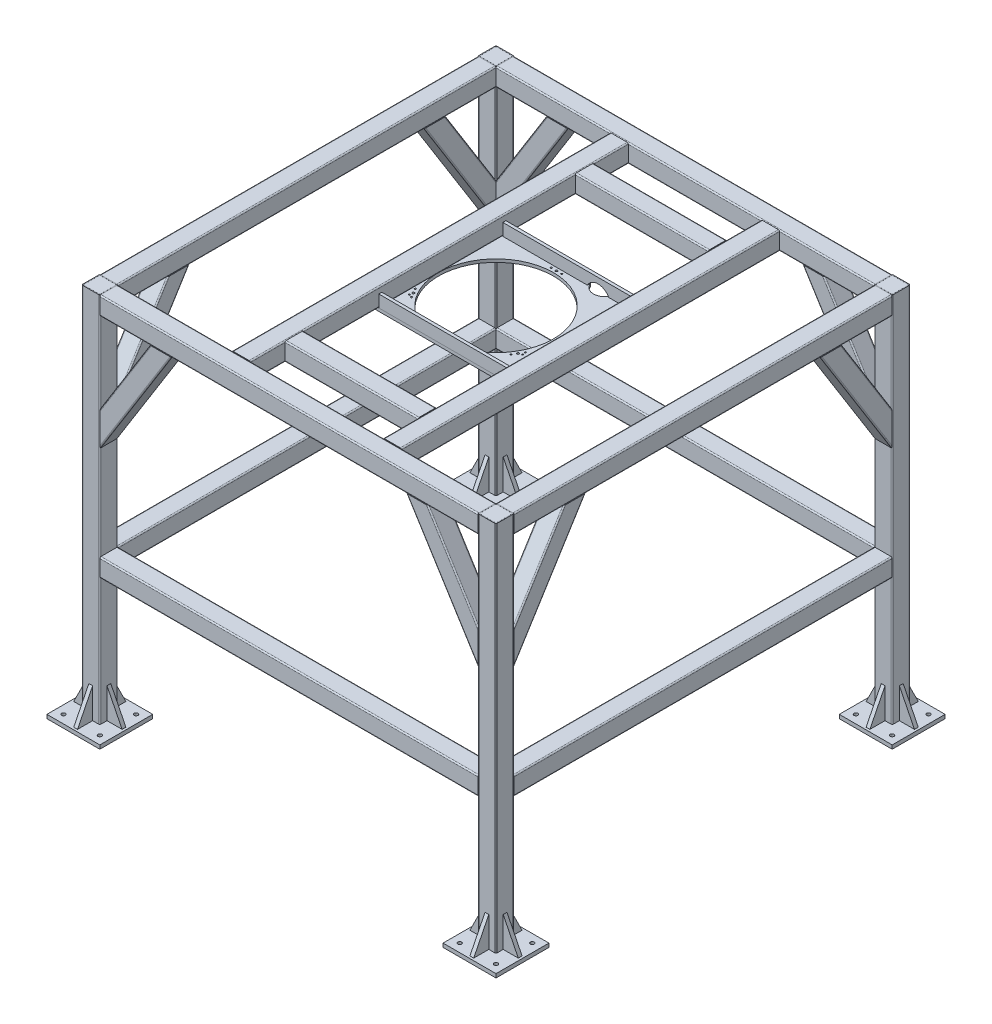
SolidWorks part; units mm, degrees
ref_plane "前视" through (0, 0, 0) normal (0, 0, 1) x (1, 0, 0)
ref_plane "上视" through (0, 0, 0) normal (0, 1, 0) x (1, 0, 0)
ref_plane "右视" through (0, 0, 0) normal (1, 0, 0) x (0, 0, -1)
sketch3d "3D草图2"
  line L0 (-1310, 0, 1310) -> (-1310, 2400, 1310)
  line L1 (-1310, 0, 1310) -> (-1310, 0, -1310)
  line L2 (-1310, 0, 1310) -> (1310, 0, 1310)
  line L3 (1310, 0, 1310) -> (1310, 0, -1310)
  line L4 (-1310, 0, -1310) -> (1310, 0, -1310)
  line L5 (-1310, 2400, 430) -> (1310, 2400, 430)
  line L6 (-1310, 2400, -430) -> (1310, 2400, -430)
  line L7 (-1310, 2400, -1310) -> (-1310, 2400, 1310)
  line L8 (-435, 2400, -1310) -> (-435, 2400, 1310)
  line L9 (-1310, 0, -1310) -> (-1310, 2400, -1310)
  line L10 (-1310, 2400, 1310) -> (1310, 2400, 1310)
  line L11 (565, 2400, -1310) -> (565, 2400, 1310)
  line L12 (1310, 2400, 1310) -> (1310, 2400, -1310)
  line L13 (1310, 2400, -1310) -> (-1310, 2400, -1310)
  line L14 (-1310, 900, 1310) -> (1310, 900, 1310)
  line L15 (1310, 900, 1310) -> (1310, 900, -1310)
  line L16 (-1310, 0, 0) -> (1310, 0, 0) construction
  line L17 (1310, 900, -1310) -> (-1310, 900, -1310)
  line L18 (-1310, 900, -1310) -> (-1310, 900, 1310)
  line L19 (-810, 2400, 1310) -> (-1310, 1600, 1310)
  line L20 (-1310, 1600, 1310) -> (-1310, 2400, 810)
  line L21 (810, 2400, 1310) -> (1310, 1600, 1310)
  line L22 (1310, 1600, 1310) -> (1310, 2400, 810)
  line L23 (1310, 2400, -810) -> (1310, 1600, -1310)
  line L24 (1310, 1600, -1310) -> (810, 2400, -1310)
  line L25 (-810, 2400, -1310) -> (-1310, 1600, -1310)
  line L26 (-1310, 1600, -1310) -> (-1310, 2400, -810)
  line L27 (-435, 2400, -960) -> (565, 2400, -960)
  line L28 (-435, 2400, 960) -> (565, 2400, 960)
  line L45 (1310, 2400, -1310) -> (1310, 0, -1310)
  line L47 (1310, 2400, 1310) -> (1310, 0, 1310)
  line L49 (1310, 2400, 0) -> (-1310, 2400, 0)
  dimension "D1" = 2620
  dimension "D2" = 2620
  dimension "D3" = 2400
  dimension "D7" = 1000
  dimension "D4" = 430
  dimension "D5" = 430
  dimension "D6" = 875
  dimension "D11" = 500
  dimension "D8" = 900
  dimension "D9" = 500
  dimension "D10" = 800
  dimension "D12" = 350
  dimension "D13" = 350
  dimension "D14" = 800
  dimension "D15" = 500
  dimension "D16" = 500
  dimension "D17" = 800
  dimension "D18" = 500
  dimension "D19" = 500
  dimension "D20" = 500
  dimension "D21" = 800
  dimension "D22" = 500
other "矩型管 120X60X4(1)"
ref_plane "基准面1" through (-1310, 0, -1310) normal (0, 1, 0) x (1, 0, 0)
sketch "Sketch12" plane through (-1310, 0, -1310) normal (0, 1, 0) x (1, 0, 0)
  line L0 (-52, -56) -> (52, -56)
  line L1 (-56, -52) -> (-56, 52)
  line L2 (52, 56) -> (-52, 56)
  line L3 (56, 52) -> (56, -52)
  line L4 (-52, -60) -> (52, -60)
  line L5 (-60, -52) -> (-60, 52)
  line L6 (52, 60) -> (-52, 60)
  line L7 (60, 52) -> (60, -52)
  arc A0 (60, 52) -> (52, 60) centre (52, 52) ccw
  arc A1 (52, -60) -> (60, -52) centre (52, -52) ccw
  arc A2 (-60, -52) -> (-52, -60) centre (-52, -52) ccw
  arc A3 (-52, 60) -> (-60, 52) centre (-52, 52) ccw
  arc A4 (-52, 56) -> (-56, 52) centre (-52, 52) ccw
  arc A5 (56, 52) -> (52, 56) centre (52, 52) ccw
  arc A6 (52, -56) -> (56, -52) centre (52, -52) ccw
  arc A7 (-56, -52) -> (-52, -56) centre (-52, -52) ccw
  point P0 (0, 60)
  point P1 (60, 0)
  point P2 (0, -60)
  point P3 (-60, 0)
  point P4 (-60, 60)
  point P5 (60, 60)
  point P6 (60, -60)
  point P7 (-60, -60)
  point P8 (0, 0)
  point P33 (0, 0)
other "剪裁/延伸7"
other "剪裁/延伸6"
sheet metal parameters "钣金2" thickness 3 parameters "D1"=0.7366
sheet metal parameters "钣金4" thickness 3 parameters "D1"=0.7366
sheet metal parameters "钣金7" thickness 1.5 parameters "D1"=0.7366
sheet metal parameters "钣金9" thickness 1.5 parameters "D1"=0.7366
sheet metal parameters "钣金15" thickness 2.5 parameters "D1"=0.7366
sheet metal parameters "钣金16" thickness 2.5 parameters "D1"=0.7366
sheet metal parameters "钣金17" thickness 2.5 parameters "D1"=0.7366
sheet metal parameters "钣金18" thickness 2.5 parameters "D1"=0.7366
sheet metal parameters "钣金19" thickness 2.5 parameters "D1"=0.7366
sheet metal parameters "钣金20" thickness 2.5 parameters "D1"=0.7366
sheet metal parameters "钣金21" thickness 2.5 parameters "D1"=0.7366
sheet metal parameters "钣金28" thickness 2.5 parameters "D1"=0.7366
sheet metal parameters "钣金29" thickness 2.5 parameters "D1"=0.7366
sheet metal parameters "钣金30" thickness 2 parameters "D1"=0.7366
other "剪裁/延伸8"
other "剪裁/延伸9"
other "剪裁/延伸10"
sketch "草图748" plane through (0, 0, 0) normal (0, -1, 0) x (1, 0, 0)
  line L6 (0, 534.4081) -> (0, 0) construction
  line L7 (0, 0) -> (-581.3586, 0) construction
  line L20 (1250, 1370) -> (-1250, 1370) construction
  line L21 (-1135, 1135) -> (-1485, 1135)
  line L22 (-1135, 1135) -> (-1135, 1485)
  line L23 (-1135, 1485) -> (-1485, 1485)
  line L24 (-1485, 1135) -> (-1485, 1485)
  line L25 (-1135, 1135) -> (-1485, 1485) construction
  line L26 (-1135, 1485) -> (-1485, 1135) construction
  line L27 (-1370, 1250) -> (-1370, -1250) construction
  line L28 (1135, 1485) -> (1485, 1135) construction
  line L29 (1135, 1135) -> (1485, 1485) construction
  line L30 (1485, 1135) -> (1485, 1485)
  line L31 (1135, 1485) -> (1485, 1485)
  line L32 (1135, 1135) -> (1135, 1485)
  line L33 (1135, 1135) -> (1485, 1135)
  line L34 (-1135, -1485) -> (-1485, -1135) construction
  line L35 (-1135, -1135) -> (-1485, -1485) construction
  line L36 (-1485, -1135) -> (-1485, -1485)
  line L37 (-1135, -1485) -> (-1485, -1485)
  line L38 (-1135, -1135) -> (-1135, -1485)
  line L39 (-1135, -1135) -> (-1485, -1135)
  line L40 (1135, -1135) -> (1485, -1485) construction
  line L41 (1135, -1485) -> (1485, -1135) construction
  line L42 (1135, -1135) -> (1485, -1135)
  line L43 (1135, -1135) -> (1135, -1485)
  line L44 (1135, -1485) -> (1485, -1485)
  line L45 (1485, -1135) -> (1485, -1485)
  point P0 (-1310, 1310)
  point P18 (1310, 1310)
  point P23 (-1310, -1310)
  point P28 (1310, -1310)
  dimension "D1" = 350
  dimension "D2" = 350
  dimension "D3" = 60
  dimension "D4" = 60
extrude "凸台-拉伸42" add sketch "草图748" along normal blind 25 separate body
sketch "草图755" plane through (0, 2340, 0) normal (0, -1, 0) x (1, 0, 0)
  line L0 (0, 0) -> (0, 240.19) construction
  line L6 (-435, 400) -> (565, 400)
  line L13 (0, 0) -> (-184.4464, 0) construction
  line L18 (-435, 400) -> (-435, -440)
  line L19 (-435, -440) -> (565, -440)
  line L20 (565, 400) -> (565, -440)
  line L21 (-375, 1250) -> (-375, -1250) construction
  line L22 (625, 1250) -> (625, -1250) construction
  circle A1 centre (0, 0) radius 380
  dimension "D1" = 840
  dimension "D2" = 760
  dimension "D3" = 400
  dimension "D4" = 60
  dimension "D5" = 60
extrude "凸台-拉伸43" add sketch "草图755" along normal blind 20 separate body
other "顶端盖1" parameters "D1"=5, "D2"=3, "D3"=3, "D4"=0
sketch "草图766" plane through (0, 2340, 0) normal (0, 1, 0) x (1, 0, 0)
  line L0 (505, -1250) -> (505, 1250) construction
  line L1 (-435, 440) -> (565, 440) construction
  circle A0 centre (255, 465) radius 75
  dimension "D1" = 250
  dimension "D2" = 150
  dimension "D3" = 25
extrude "切除-拉伸1" cut sketch "草图766" against normal through all
hole_wizard "M16 螺纹孔2" positions "草图767" profile "草图768" tap size "M16" standard "GB"
sketch "草图767" plane through (0, 2340, 0) normal (0, 1, 0) x (1, 0, 0)
  point P0 (0, 400)
  dimension "D1" = 400
sketch "草图768" plane through (0, 2340, -400) normal (1, 0, 0) x (0, 0, 1)
  line L0 (0, 0) -> (0, 42.206)
  line L1 (0, 42.206) -> (7, 38)
  line L2 (7, 38) -> (7, 0)
  line L5 (7, 0) -> (0, 0)
  line L10 (0, 42.206) -> (-7, 38) construction
  line L11 (0, -6.35) -> (0, 107.95) construction
  dimension "螺纹孔钻头直径" = 14
  dimension "螺纹孔钻头深度" = 38
  dimension "导头角度" = 118
hole_wizard "M12 螺纹孔2" positions "草图769" profile "草图770" tap size "M12" standard "GB"
sketch "草图769" plane through (0, 2340, 0) normal (0, 1, 0) x (1, 0, 0)
  line L0 (0, 0) -> (0, 157.172) construction
  line L2 (-35, 400) -> (0, 0) construction
  line L4 (35, 400) -> (0, 0) construction
  circle A0 centre (0, 400) radius 7 construction
  point P0 (35, 400)
  point P2 (-35, 400)
  dimension "D3" = 35
  dimension "D1" = 400
  dimension "D2" = 35
sketch "草图770" plane through (35, 2340, -400) normal (1, 0, 0) x (0, 0, 1)
  line L0 (0, 0) -> (0, 35.8144)
  line L1 (0, 35.8144) -> (5.1, 32.75)
  line L2 (5.1, 32.75) -> (5.1, 0)
  line L5 (5.1, 0) -> (0, 0)
  line L10 (0, 35.8144) -> (-5.1, 32.75) construction
  line L11 (0, -6.35) -> (0, 107.95) construction
  dimension "螺纹孔钻头直径" = 10.2
  dimension "螺纹孔钻头深度" = 32.75
  dimension "导头角度" = 118
pattern_circular "阵列(圆周)2" count 3 over 360 about axis through (0, 0, 0) along (0, 1, 0) of "M16 螺纹孔2", "M12 螺纹孔2"
sketch "草图771" plane through (0, 2340, 0) normal (0, 1, 0) x (1, 0, 0)
  line L0 (-375, -1250) -> (-375, 1250) construction
  line L1 (-375, 440) -> (505, 440)
  line L2 (-375, 440) -> (-375, 420)
  line L3 (-375, 420) -> (505, 420)
  line L4 (505, 440) -> (505, 420)
  line L5 (-435, 440) -> (184.2893, 440) construction
  line L6 (505, -1250) -> (505, 1250) construction
  line L7 (0, 0) -> (125.4763, 0) construction
  line L12 (565, -400) -> (-435, -400) construction
  line L13 (-375, -400) -> (505, -400)
  line L14 (-375, -400) -> (-375, -380)
  line L15 (-375, -380) -> (505, -380)
  line L16 (505, -400) -> (505, -380)
  dimension "D1" = 20
  dimension "D2" = 20
extrude "凸台-拉伸45" add sketch "草图771" along normal blind 80 separate body
sketch "草图772" plane through (0, 0, -440) normal (0, 0, -1) x (-1, 0, 0)
  line L0 (-505, 2340) -> (375, 2340) construction
  line L1 (-184.2893, 2340) -> (-184.2893, 2320) construction
  line L2 (-325.7107, 2340) -> (-184.2893, 2340)
  arc A1 (-325.7107, 2340) -> (-184.2893, 2340) centre (-255, 2302.5834) cw
  dimension "D1" = 80
extrude "切除-拉伸2" cut sketch "草图772" against normal blind 20 and the other way through all
hole_wizard "大小mm 暗销孔1" positions "草图773" profile "草图774" hole size "Ø10.0" standard "GB"
sketch "草图773" plane through (0, 2340, 0) normal (0, 1, 0) x (1, 0, 0)
  line L0 (0, 0) -> (0, -491.527) construction
  line L2 (0, 0) -> (-350.0075, -222.9793) construction
  line L5 (0, 0) -> (368.1095, -191.6257) construction
  point P0 (-350.0075, -222.9793)
  point P25 (368.1095, -191.6257)
  dimension "D1" = 57.5
  dimension "D2" = 415
  dimension "D3" = 62.5
  dimension "D4" = 415
sketch "草图774" plane through (-350.0075, 2340, 222.9793) normal (1, 0, 0) x (0, 0, 1)
  line L0 (0, 0) -> (0, 35.7543)
  line L1 (0, 35.7543) -> (5, 32.75)
  line L2 (5, 32.75) -> (5, 0)
  line L5 (5, 0) -> (0, 0)
  line L10 (0, 35.7543) -> (-5, 32.75) construction
  line L11 (0, -6.35) -> (0, 107.95) construction
  dimension "孔直径" = 10
  dimension "孔深度" = 32.75
  dimension "导头角度" = 118
hole_wizard "大小mm 暗销孔2" positions "草图777" profile "草图778" hole size "Ø25.0" standard "GB"
sketch "草图777" plane through (0, -25, 0) normal (0, -1, 0) x (-1, 0, 0)
  line L0 (1310, 1485) -> (1310, 1340.0806) construction
  line L1 (1485, 1485) -> (1135, 1485) construction
  line L3 (1485, 1310) -> (1341.1589, 1310) construction
  line L4 (1485, 1135) -> (1485, 1485) construction
  line L6 (0, 0) -> (710.3979, 0) construction
  line L10 (0, 0) -> (0, 304.3272) construction
  line L16 (1485, -1310) -> (1341.1589, -1310) construction
  line L17 (1310, -1485) -> (1310, -1340.0806) construction
  line L18 (-1310, -1485) -> (-1310, -1340.0806) construction
  line L19 (-1485, -1310) -> (-1341.1589, -1310) construction
  line L20 (-1485, 1310) -> (-1341.1589, 1310) construction
  line L21 (-1310, 1485) -> (-1310, 1340.0806) construction
  point P0 (1430, 1430)
  point P2 (1430, 1190)
  point P4 (1190, 1190)
  point P6 (1190, 1430)
  point P81 (1190, -1430)
  point P82 (1190, -1190)
  point P83 (1430, -1190)
  point P84 (1430, -1430)
  point P93 (-1430, -1430)
  point P94 (-1430, -1190)
  point P95 (-1190, -1190)
  point P96 (-1190, -1430)
  point P105 (-1190, 1430)
  point P106 (-1190, 1190)
  point P107 (-1430, 1190)
  point P108 (-1430, 1430)
  dimension "D1" = 240
  dimension "D2" = 240
sketch "草图778" plane through (-1430, -25, -1430) normal (1, 0, 0) x (0, 0, -1)
  line L0 (0, 0) -> (0, 40.2608)
  line L1 (0, 40.2608) -> (12.5, 32.75)
  line L2 (12.5, 32.75) -> (12.5, 0)
  line L5 (12.5, 0) -> (0, 0)
  line L10 (0, 40.2608) -> (-12.5, 32.75) construction
  line L11 (0, -6.35) -> (0, 107.95) construction
  dimension "孔直径" = 25
  dimension "孔深度" = 32.75
  dimension "导头角度" = 118
other "角撑板1" parameters "D1"=25, "D2"=25, "D3"=0, "D4"=0, "D10"=5, "D11"=200, "D12"=100, "D13"=15, "D14"=45, "D15"=15
sketch "草图779" plane through (-1310, 0, -1370) normal (-1, 0, 0) x (0, 0, 1)
  line L0 (0, 0) -> (0, 200)
  line L1 (0, 0) -> (-100, 0)
  line L2 (0, 200) -> (-100, 0)
other "角撑板2" parameters "D1"=25, "D2"=25, "D3"=0, "D4"=0, "D10"=5, "D11"=200, "D12"=100, "D13"=15, "D14"=45, "D15"=15
sketch "草图780" plane through (-1370, 0, -1310) normal (0, 0, 1) x (1, 0, 0)
  line L0 (0, 0) -> (0, 200)
  line L1 (0, 0) -> (-100, 0)
  line L2 (0, 200) -> (-100, 0)
other "角撑板3" parameters "D1"=25, "D2"=25, "D3"=0, "D4"=0, "D10"=5, "D11"=200, "D12"=100, "D13"=15, "D14"=45, "D15"=15
sketch "草图781" plane through (-1310, 0, -1250) normal (1, 0, 0) x (0, 0, -1)
  line L0 (0, 0) -> (0, 200)
  line L1 (0, 0) -> (-100, 0)
  line L2 (0, 200) -> (-100, 0)
other "角撑板4" parameters "D1"=25, "D2"=25, "D3"=0, "D4"=0, "D10"=5, "D11"=200, "D12"=100, "D13"=15, "D14"=45, "D15"=15
sketch "草图782" plane through (-1250, 0, -1310) normal (0, 0, -1) x (-1, 0, 0)
  line L0 (0, 0) -> (0, 200)
  line L1 (0, 0) -> (-100, 0)
  line L2 (0, 200) -> (-100, 0)
other "角撑板5" parameters "D1"=25, "D2"=25, "D3"=0, "D4"=0, "D10"=5, "D11"=200, "D12"=100, "D13"=15, "D14"=45, "D15"=15
sketch "草图783" plane through (1310, 0, -1370) normal (-1, 0, 0) x (0, 0, 1)
  line L0 (0, 0) -> (0, 200)
  line L1 (0, 0) -> (-100, 0)
  line L2 (0, 200) -> (-100, 0)
other "角撑板6" parameters "D1"=25, "D2"=25, "D3"=0, "D4"=0, "D10"=5, "D11"=200, "D12"=100, "D13"=15, "D14"=45, "D15"=15
sketch "草图784" plane through (1250, 0, -1310) normal (0, 0, 1) x (1, 0, 0)
  line L0 (0, 0) -> (0, 200)
  line L1 (0, 0) -> (-100, 0)
  line L2 (0, 200) -> (-100, 0)
other "角撑板7" parameters "D1"=25, "D2"=25, "D3"=0, "D4"=0, "D10"=5, "D11"=200, "D12"=100, "D13"=15, "D14"=45, "D15"=15
sketch "草图785" plane through (1370, 0, -1310) normal (0, 0, -1) x (-1, 0, 0)
  line L0 (0, 0) -> (0, 200)
  line L1 (0, 0) -> (-100, 0)
  line L2 (0, 200) -> (-100, 0)
other "角撑板8" parameters "D1"=25, "D2"=25, "D3"=0, "D4"=0, "D10"=5, "D11"=200, "D12"=100, "D13"=15, "D14"=45, "D15"=15
sketch "草图786" plane through (1310, 0, -1250) normal (1, 0, 0) x (0, 0, -1)
  line L0 (0, 0) -> (0, 200)
  line L1 (0, 0) -> (-100, 0)
  line L2 (0, 200) -> (-100, 0)
other "角撑板9" parameters "D1"=25, "D2"=25, "D3"=0, "D4"=0, "D10"=5, "D11"=200, "D12"=100, "D13"=15, "D14"=45, "D15"=15
sketch "草图787" plane through (1370, 0, 1310) normal (0, 0, -1) x (-1, 0, 0)
  line L0 (0, 0) -> (0, 200)
  line L1 (0, 0) -> (-100, 0)
  line L2 (0, 200) -> (-100, 0)
other "角撑板10" parameters "D1"=25, "D2"=25, "D3"=0, "D4"=0, "D10"=5, "D11"=200, "D12"=100, "D13"=15, "D14"=45, "D15"=15
sketch "草图788" plane through (1310, 0, 1370) normal (1, 0, 0) x (0, 0, -1)
  line L0 (0, 0) -> (0, 200)
  line L1 (0, 0) -> (-100, 0)
  line L2 (0, 200) -> (-100, 0)
other "角撑板11" parameters "D1"=25, "D2"=25, "D3"=0, "D4"=0, "D10"=5, "D11"=200, "D12"=100, "D13"=15, "D14"=45, "D15"=15
sketch "草图789" plane through (1310, 0, 1250) normal (-1, 0, 0) x (0, 0, 1)
  line L0 (0, 0) -> (0, 200)
  line L1 (0, 0) -> (-100, 0)
  line L2 (0, 200) -> (-100, 0)
other "角撑板12" parameters "D1"=25, "D2"=25, "D3"=0, "D4"=0, "D10"=5, "D11"=200, "D12"=100, "D13"=15, "D14"=45, "D15"=15
sketch "草图790" plane through (1250, 0, 1310) normal (0, 0, 1) x (1, 0, 0)
  line L0 (0, 0) -> (0, 200)
  line L1 (0, 0) -> (-100, 0)
  line L2 (0, 200) -> (-100, 0)
other "角撑板13" parameters "D1"=25, "D2"=25, "D3"=0, "D4"=0, "D10"=5, "D11"=200, "D12"=100, "D13"=15, "D14"=45, "D15"=15
sketch "草图791" plane through (-1370, 0, 1310) normal (0, 0, 1) x (1, 0, 0)
  line L0 (0, 0) -> (0, 200)
  line L1 (0, 0) -> (-100, 0)
  line L2 (0, 200) -> (-100, 0)
other "角撑板14" parameters "D1"=25, "D2"=25, "D3"=0, "D4"=0, "D10"=5, "D11"=200, "D12"=100, "D13"=15, "D14"=45, "D15"=15
sketch "草图792" plane through (-1310, 0, 1370) normal (1, 0, 0) x (0, 0, -1)
  line L0 (0, 0) -> (0, 200)
  line L1 (0, 0) -> (-100, 0)
  line L2 (0, 200) -> (-100, 0)
other "角撑板15" parameters "D1"=25, "D2"=25, "D3"=0, "D4"=0, "D10"=5, "D11"=200, "D12"=100, "D13"=15, "D14"=45, "D15"=15
sketch "草图793" plane through (-1250, 0, 1310) normal (0, 0, -1) x (-1, 0, 0)
  line L0 (0, 0) -> (0, 200)
  line L1 (0, 0) -> (-100, 0)
  line L2 (0, 200) -> (-100, 0)
other "角撑板16" parameters "D1"=25, "D2"=25, "D3"=0, "D4"=0, "D10"=5, "D11"=200, "D12"=100, "D13"=15, "D14"=45, "D15"=15
sketch "草图794" plane through (-1310, 0, 1250) normal (-1, 0, 0) x (0, 0, 1)
  line L0 (0, 0) -> (0, 200)
  line L1 (0, 0) -> (-100, 0)
  line L2 (0, 200) -> (-100, 0)
flat pattern "平板型式2"
sketch "折弯-线2" plane through (0, 0, 0) normal (0, 1, 0) x (1, 0, 0)
sketch "边界框2" [suppressed] plane through (0, 0, 0) normal (0, 1, 0) x (1, 0, 0)
flat pattern "平板型式4"
sketch "折弯-线4" plane through (0, 0, 0) normal (0, 1, 0) x (1, 0, 0)
sketch "边界框4" [suppressed] plane through (0, 0, 0) normal (0, 1, 0) x (1, 0, 0)
flat pattern "平板型式7"
sketch "折弯-线7" plane through (0, 0, 0) normal (0, 1, 0) x (1, 0, 0)
sketch "边界框7" [suppressed] plane through (0, 0, 0) normal (0, 1, 0) x (1, 0, 0)
flat pattern "平板型式9"
sketch "折弯-线9" plane through (0, 0, 0) normal (0, 1, 0) x (1, 0, 0)
sketch "边界框9" [suppressed] plane through (0, 0, 0) normal (0, 1, 0) x (1, 0, 0)
flat pattern "平板型式15"
sketch "折弯-线15" plane through (0, 0, 0) normal (0, 1, 0) x (1, 0, 0)
sketch "边界框15" [suppressed] plane through (0, 0, 0) normal (0, 1, 0) x (1, 0, 0)
flat pattern "平板型式16"
sketch "折弯-线16" plane through (0, 0, 0) normal (0, 1, 0) x (1, 0, 0)
sketch "边界框16" [suppressed] plane through (0, 0, 0) normal (0, 1, 0) x (1, 0, 0)
flat pattern "平板型式17"
sketch "折弯-线17" plane through (0, 0, 0) normal (0, 1, 0) x (1, 0, 0)
sketch "边界框17" [suppressed] plane through (0, 0, 0) normal (0, 1, 0) x (1, 0, 0)
flat pattern "平板型式18"
sketch "折弯-线18" plane through (0, 0, 0) normal (0, 1, 0) x (1, 0, 0)
sketch "边界框18" [suppressed] plane through (0, 0, 0) normal (0, 1, 0) x (1, 0, 0)
flat pattern "平板型式19"
sketch "折弯-线19" plane through (0, 0, 0) normal (0, 1, 0) x (1, 0, 0)
sketch "边界框19" [suppressed] plane through (0, 0, 0) normal (0, 1, 0) x (1, 0, 0)
flat pattern "平板型式20"
sketch "折弯-线20" plane through (0, 0, 0) normal (0, 1, 0) x (1, 0, 0)
sketch "边界框20" [suppressed] plane through (0, 0, 0) normal (0, 1, 0) x (1, 0, 0)
flat pattern "平板型式21"
sketch "折弯-线21" plane through (0, 0, 0) normal (0, 1, 0) x (1, 0, 0)
sketch "边界框21" [suppressed] plane through (0, 0, 0) normal (0, 1, 0) x (1, 0, 0)
flat pattern "平板型式28"
sketch "折弯-线28" plane through (0, 0, 0) normal (0, 1, 0) x (1, 0, 0)
sketch "边界框28" [suppressed] plane through (0, 0, 0) normal (0, 1, 0) x (1, 0, 0)
flat pattern "平板型式29"
sketch "折弯-线29" plane through (0, 0, 0) normal (0, 1, 0) x (1, 0, 0)
sketch "边界框29" [suppressed] plane through (0, 0, 0) normal (0, 1, 0) x (1, 0, 0)
flat pattern "平板型式30"
sketch "折弯-线30" plane through (0, 0, 0) normal (0, 1, 0) x (1, 0, 0)
sketch "边界框30" [suppressed] plane through (0, 0, 0) normal (0, 1, 0) x (1, 0, 0)
equation "\"D1@Sketch12\" = \"Thickness@Sketch12\" * 2"
